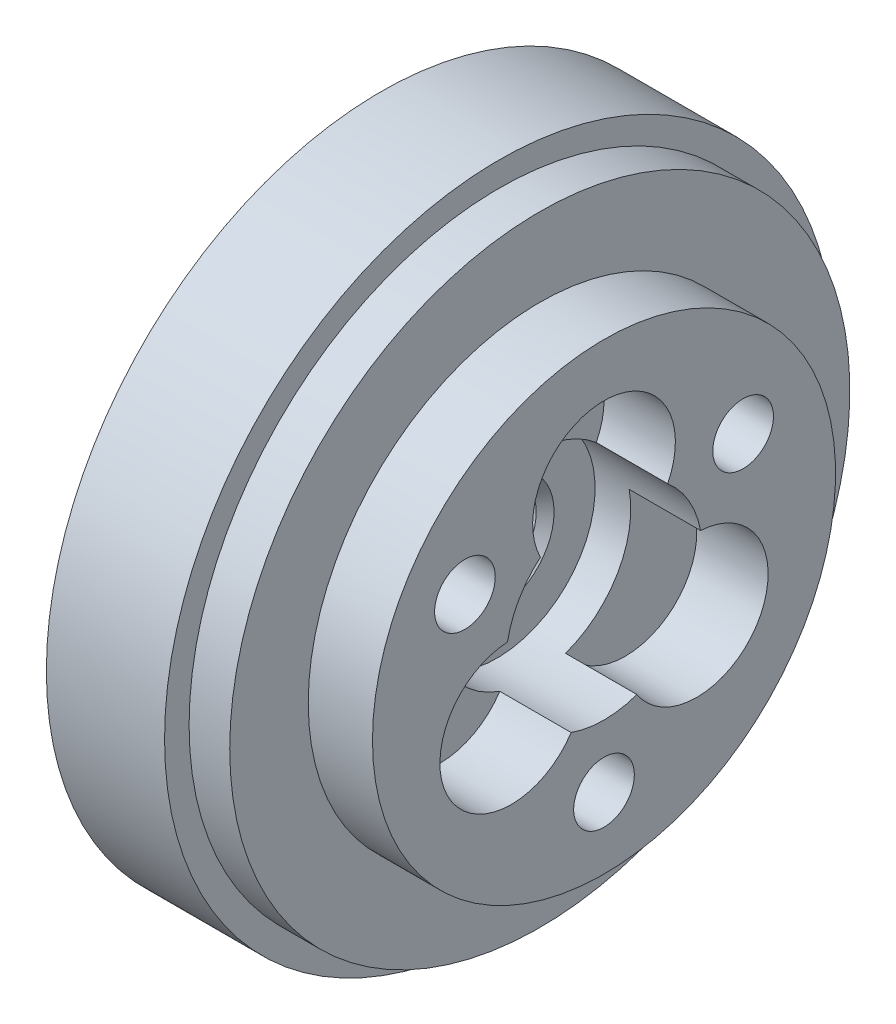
SolidWorks part; units mm, degrees
ref_plane "Plan de face" through (0, 0, 0) normal (0, 0, 1) x (1, 0, 0)
ref_plane "Plan de dessus" through (0, 0, 0) normal (0, 1, 0) x (1, 0, 0)
ref_plane "Plan de droite" through (0, 0, 0) normal (1, 0, 0) x (0, 0, -1)
sketch "Esquisse1" plane through (0, 0, 0) normal (0, 0, 1) x (1, 0, 0)
  line L0 (0, 0) -> (89.9204, 0) construction
  line L1 (0, 0) -> (0, 37.5)
  line L2 (0, 37.5) -> (13.246, 37.5)
  line L3 (13.246, 37.5) -> (13.246, 34.75)
  line L4 (13.246, 34.75) -> (17.8, 34.75)
  line L5 (17.8, 34.75) -> (17.8, 25.95)
  line L6 (17.8, 25.95) -> (25, 25.95)
  line L7 (25, 25.95) -> (25, 0)
  line L8 (0, 0) -> (25, 0)
  dimension "D1" = 69.5
  dimension "D2" = 75
  dimension "D4" = 51.9
  dimension "D6" = 7.2
revolve "Révolution1" add sketch "Esquisse1" angle 360 about L0
sketch "Esquisse2" plane through (0, 0, 0) normal (0, 0, 1) x (1, 0, 0)
  line L0 (0, 0) -> (44.8224, 0) construction
  line L1 (0, 2.01) -> (6, 2.01)
  line L2 (0, 37.5) -> (0, -37.5) construction
  line L3 (0, 2.01) -> (0, 0)
  line L4 (6, 2.01) -> (6, 5.4)
  line L5 (6, 5.4) -> (13, 5.4)
  line L6 (13, 5.4) -> (13, 11)
  line L7 (13, 11) -> (25, 11)
  line L8 (25, -25.95) -> (25, 25.95) construction
  line L9 (25, 11) -> (25, 0)
  line L10 (0, 0) -> (25, 0)
  dimension "D1" = 4.02
  dimension "D2" = 10.8
  dimension "D3" = 22
  dimension "D4" = 12
  dimension "D5" = 7
revolve "Enlèvement de matière-Révolution1" cut sketch "Esquisse2" angle 360 about L0
chamfer "Chanfrein1" distance 0.2 angle 45 2 edges at (6, 0, 2.01) (0, 0, 2.01)
chamfer "Chanfrein2" distance 1 angle 45 1 edges at (13, 0, 5.4)
sketch "Esquisse3" plane through (25, 0, 0) normal (1, 0, 0) x (0, 0, -1)
  line L0 (0, 0) -> (0, 45.8465) construction
  line L2 (0, 0) -> (-10.3923, -6) construction
  line L3 (0, 0) -> (10.3923, -6) construction
  circle A0 centre (0, 0) radius 12 construction
  circle A1 centre (0, 12) radius 8
  circle A2 centre (10.3923, -6) radius 8
  circle A3 centre (-10.3923, -6) radius 8
  dimension "D1" = 24
  dimension "D2" = 16
  dimension "D3" = 16
  dimension "D4" = 16
  dimension "D5" = 120
  dimension "D6" = 120
extrude "Enlèv. mat.-Extru.1" cut sketch "Esquisse3" against normal blind 8
sketch "Esquisse6" plane through (25, 0, 0) normal (1, 0, 0) x (0, 0, -1)
  point P0 (0, 0)
sketch "Esquisse7" plane through (25, 0, 0) normal (1, 0, 0) x (0, 0, -1)
  line L0 (0, 0) -> (0, -42.8874) construction
  line L1 (0, 0) -> (38.1299, 22.0143) construction
  line L2 (0, 0) -> (-35.667, 20.5923) construction
  circle A0 centre (0, 0) radius 18
  point P7 (-15.5885, 9)
  point P8 (0, -18)
  point P9 (15.5885, 9)
  dimension "D3" = 36
  dimension "D1" = 120
  dimension "D2" = 120
hole_wizard "Trou taraudé M81" positions "Esquisse3D1" profile "Esquisse8" tap size "M8" standard "ISO"
sketch3d "Esquisse3D1"
  point P0 (25, 9, 15.5885)
  point P3 (25, 9, -15.5885)
  point P6 (25, -18, 0)
sketch "Esquisse8" plane through (25, 9, 15.5885) normal (0, 1, 0) x (0, 0, -1)
  line L0 (0, 0) -> (0, 15.7929)
  line L1 (0, 15.7929) -> (3.4, 13.75)
  line L2 (3.4, 13.75) -> (3.4, 0)
  line L5 (3.4, 0) -> (0, 0)
  line L10 (0, 15.7929) -> (-3.4, 13.75) construction
  line L11 (0, -6.35) -> (0, 107.95) construction
  dimension "Diamètre du trou pour taraudage" = 6.8
  dimension "Profondeur du trou pour taraudage" = 13.75
  dimension "Angle de pointe" = 118
